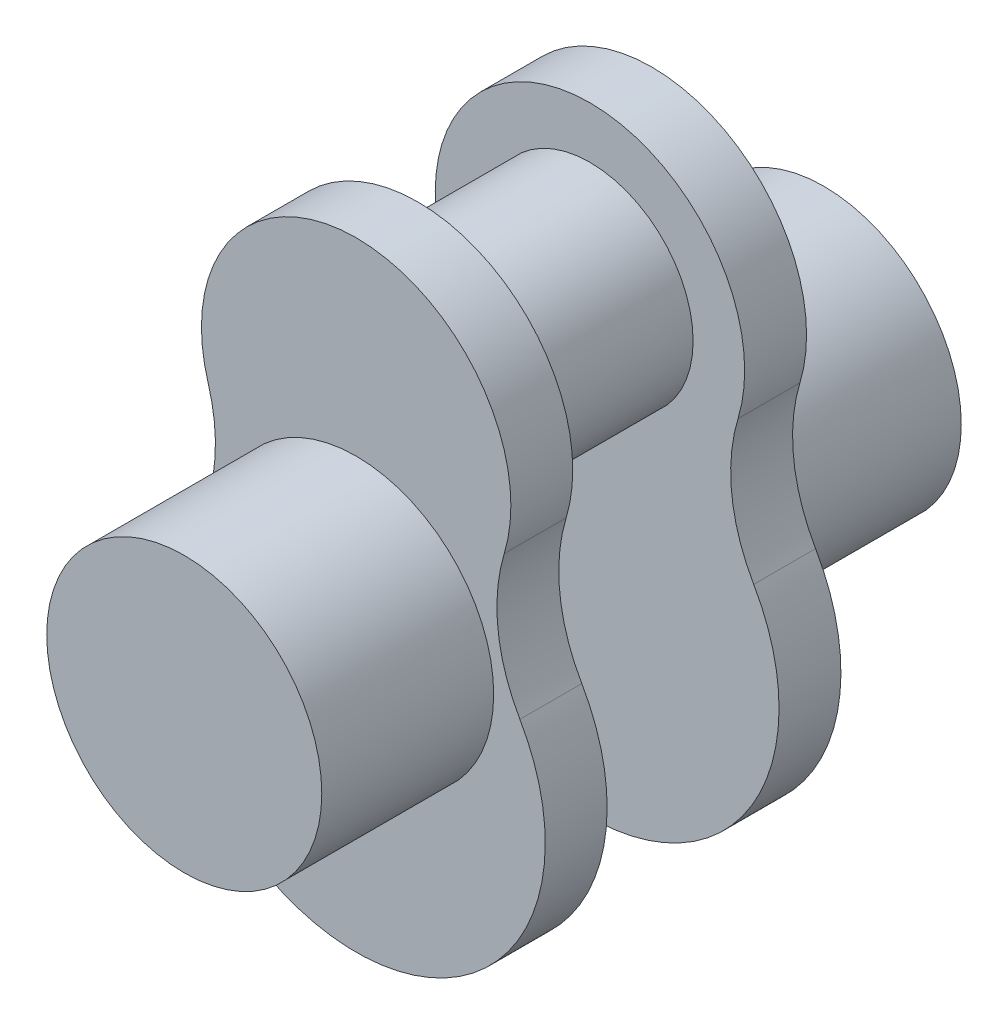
SolidWorks part; units mm, degrees
ref_plane "Płaszczyzna przednia" through (0, 0, 0) normal (0, 0, 1) x (1, 0, 0)
ref_plane "Płaszczyzna górna" through (0, 0, 0) normal (0, 1, 0) x (1, 0, 0)
ref_plane "Płaszczyzna prawa" through (0, 0, 0) normal (1, 0, 0) x (0, 0, -1)
sketch "Szkic1" plane through (0, 0, 0) normal (0, 0, 1) x (1, 0, 0)
  circle A0 centre (0, 50) radius 30
  dimension "D1" = 60
  dimension "D2" = 50
extrude "Wyciągnięcie1" add sketch "Szkic1" along normal mid plane 50
sketch "Szkic2" plane through (0, 0, 25) normal (0, 0, 1) x (1, 0, 0)
  arc A0 (43.0734, 36.9737) -> (-43.0734, 36.9737) centre (0, 50) ccw
  arc A1 (-47.6314, -2.5) -> (47.6314, -2.5) centre (0, -30) ccw
  circle A2 centre (0, 50) radius 30 construction
  arc A3 (47.6314, -2.5) -> (43.0734, 36.9737) centre (90.9327, 22.5) cw
  arc A4 (-47.6314, -2.5) -> (-43.0734, 36.9737) centre (-90.9327, 22.5) ccw
  dimension "D1" = 50
  dimension "D2" = 45
  dimension "D3" = 55
  dimension "D4" = 80
extrude "Wyciągnięcie2" add sketch "Szkic2" along normal blind 18
sketch "Szkic3" plane through (0, 0, 43) normal (0, 0, 1) x (1, 0, 0)
  circle A0 centre (0, 0) radius 40
  dimension "D1" = 80
extrude "Wyciągnięcie3" add sketch "Szkic3" along normal blind 50
mirror "Lustro1" about plane through (0, 0, 0) normal (0, 0, 1) of "Wyciągnięcie3", "Wyciągnięcie2"
